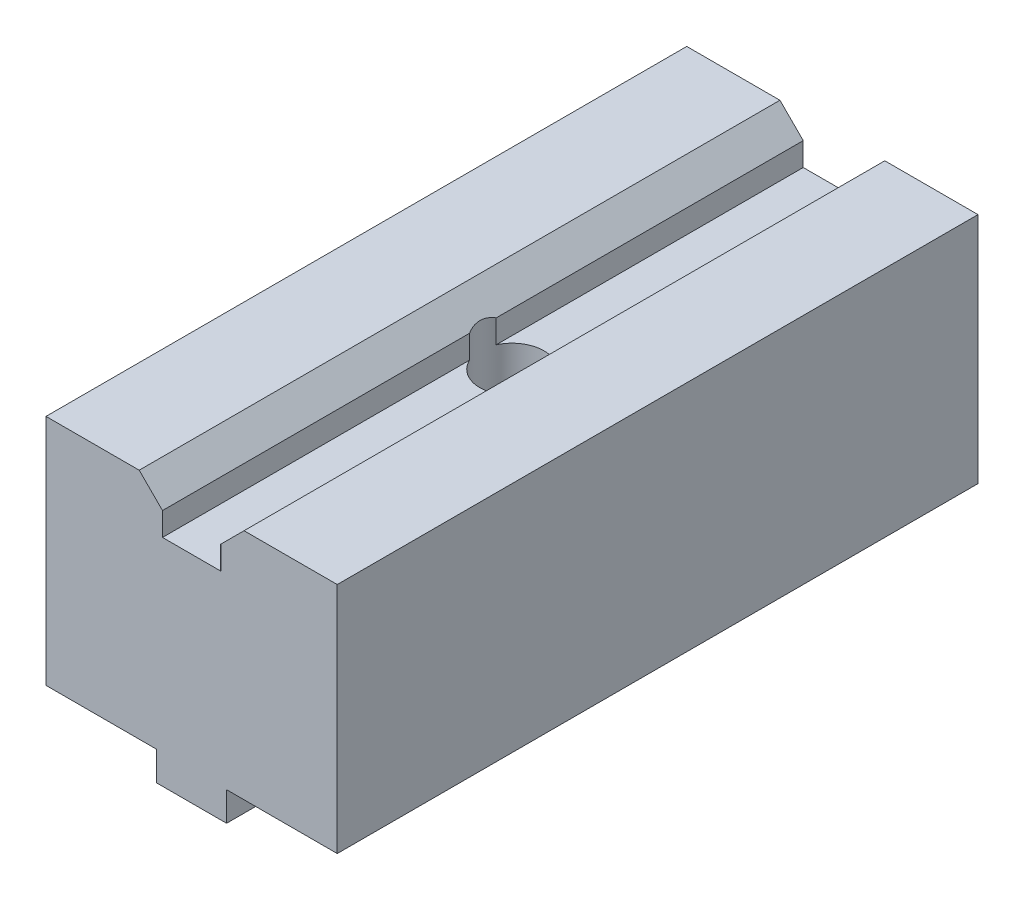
SolidWorks part; units mm, degrees
ref_plane "Ebene vorne" through (0, 0, 0) normal (0, 0, 1) x (1, 0, 0)
ref_plane "Ebene oben" through (0, 0, 0) normal (0, 1, 0) x (1, 0, 0)
ref_plane "Ebene rechts" through (0, 0, 0) normal (1, 0, 0) x (0, 0, -1)
sketch "Skizze1" plane through (0, 0, 0) normal (0, 0, 1) x (1, 0, 0)
  line L0 (0, 10.1887) -> (0, -17.0748) construction
  line L1 (12.5, -13.4678) -> (-12.5, -13.4678)
  line L2 (-12.5, -13.4678) -> (-12.5, 6.5322)
  line L3 (-12.5, 6.5322) -> (-4.5, 6.5322)
  line L4 (-4.5, 6.5322) -> (-2.5, 4.5322)
  line L5 (-2.5, 4.5322) -> (-2.5, 2.5322)
  line L6 (-2.5, 2.5322) -> (2.5, 2.5322)
  line L7 (2.5, 4.5322) -> (2.5, 2.5322)
  line L8 (4.5, 6.5322) -> (2.5, 4.5322)
  line L9 (12.5, 6.5322) -> (4.5, 6.5322)
  line L10 (12.5, -13.4678) -> (12.5, 6.5322)
  point P11 (0, 2.5322)
  point P15 (0, -13.4678)
  dimension "D1" = 25
  dimension "D2" = 20
  dimension "D3" = 4
  dimension "D4" = 2
  dimension "D5" = 45
  dimension "D6" = 5
extrude "Aufsatz-Linear austragen1" add sketch "Skizze1" along normal mid plane 55
sketch "Skizze2" plane through (0, 0, 27.5) normal (0, 0, 1) x (1, 0, 0)
  line L0 (0, 2.5322) -> (0, -13.4678) construction
  line L1 (2.5, 2.5322) -> (-2.5, 2.5322) construction
  line L2 (-12.5, -13.4678) -> (12.5, -13.4678) construction
  line L3 (-3, -13.4678) -> (-3, -10.9678)
  line L4 (-3, -10.9678) -> (3, -10.9678)
  line L5 (3, -10.9678) -> (3, -13.4678)
  line L6 (3, -13.4678) -> (-3, -13.4678)
  dimension "D1" = 2.5
  dimension "D2" = 6
extrude "Schnitt-Linear austragen1" [suppressed] cut sketch "Skizze2" against normal through all
hole_wizard "Stirnsenkung für M2.5 Zylinderschraube mit Innensechskant1" positions "Skizze5" profile "Skizze4" counterbore size "M2.5" standard "DIN"
sketch "Skizze5" plane through (0, 6.5322, 0) normal (0, 1, 0) x (1, 0, 0)
  line L0 (0, -27.5) -> (0, 27.5) construction
  line L1 (2.5, -27.5) -> (-2.5, -27.5) construction
  line L2 (2.5, 27.5) -> (-2.5, 27.5) construction
  line L4 (-12.5, 0) -> (12.5, 0) construction
  line L5 (-12.5, -27.5) -> (-12.5, 27.5) construction
  line L6 (12.5, -27.5) -> (12.5, 27.5) construction
  point P0 (0, 15)
  point P18 (0, -15)
  dimension "D1" = 30
sketch "Skizze4" plane through (0, 6.5322, -15) normal (1, 0, 0) x (0, 0, 1)
  line L0 (0, 0) -> (0, 20)
  line L1 (0, 20) -> (1.45, 20)
  line L3 (1.45, 20) -> (1.45, 10)
  line L4 (1.45, 10) -> (2.75, 10)
  line L5 (2.75, 10) -> (2.75, 0)
  line L7 (2.75, 0) -> (0, 0)
  line L11 (0, -6.35) -> (0, 107.95) construction
  dimension "Bohrerdurchmesser" = 2.9
  dimension "Bohrungstiefe" = 20
  dimension "Senkdurchmesser2" = 5.5
  dimension "Senktiefe2" = 10
sketch "Skizze6" plane through (0, 0, 27.5) normal (0, 0, 1) x (1, 0, 0)
  line L0 (0, 2.5322) -> (0, -16.4484) construction
  line L1 (2.5, 2.5322) -> (-2.5, 2.5322) construction
  line L2 (-3, -13.4678) -> (-3, -15.9678)
  line L3 (-12.5, -13.4678) -> (12.5, -13.4678) construction
  line L4 (-3, -15.9678) -> (3, -15.9678)
  line L5 (3, -15.9678) -> (3, -13.4678)
  line L6 (3, -13.4678) -> (-3, -13.4678)
  dimension "D1" = 2.5
  dimension "D2" = 6
extrude "Aufsatz-Linear austragen2" add sketch "Skizze6" against normal through all
hole_wizard "Stirnsenkung für M2.5 Zylinderschraube mit Innensechskant2" positions "Skizze8" profile "Skizze7" counterbore size "M2.5" standard "DIN"
sketch "Skizze8" plane through (0, 6.5322, 0) normal (0, 1, 0) x (1, 0, 0)
  point P0 (0, 0)
sketch "Skizze7" plane through (0, 6.5322, 0) normal (1, 0, 0) x (0, 0, 1)
  line L0 (0, 0) -> (0, 22.5)
  line L1 (0, 22.5) -> (1.45, 22.5)
  line L3 (1.45, 22.5) -> (1.45, 10)
  line L4 (1.45, 10) -> (2.75, 10)
  line L5 (2.75, 10) -> (2.75, 0)
  line L7 (2.75, 0) -> (0, 0)
  line L11 (0, -6.35) -> (0, 107.95) construction
  dimension "Bohrerdurchmesser" = 2.9
  dimension "Bohrungstiefe" = 22.5
  dimension "Senkdurchmesser2" = 5.5
  dimension "Senktiefe2" = 10
